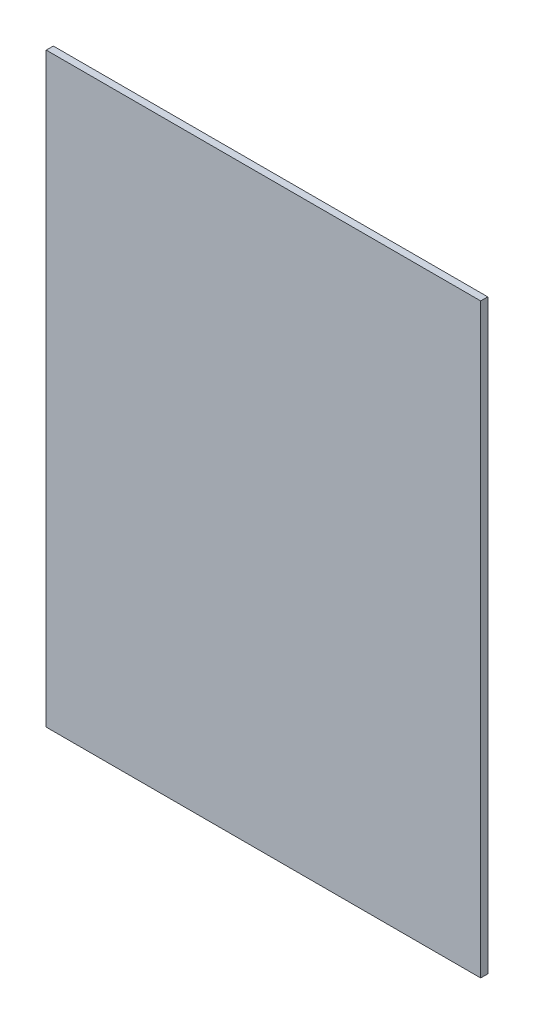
SolidWorks part; units mm, degrees
ref_plane "Plan de face" through (0, 0, 0) normal (0, 0, 1) x (1, 0, 0)
ref_plane "Plan de dessus" through (0, 0, 0) normal (0, 1, 0) x (1, 0, 0)
ref_plane "Plan de droite" through (0, 0, 0) normal (1, 0, 0) x (0, 0, -1)
sketch "Esquisse1" plane through (0, 0, 0) normal (0, 0, 1) x (1, 0, 0)
  line L0 (615, 830) -> (0, 830)
  line L1 (0, 0) -> (615, 0)
  line L2 (0, 0) -> (0, 830)
  line L4 (615, 0) -> (615, 830)
  dimension "D1" = 615
  dimension "D2" = 830
extrude "Extrusion1" add sketch "Esquisse1" along normal blind 10
